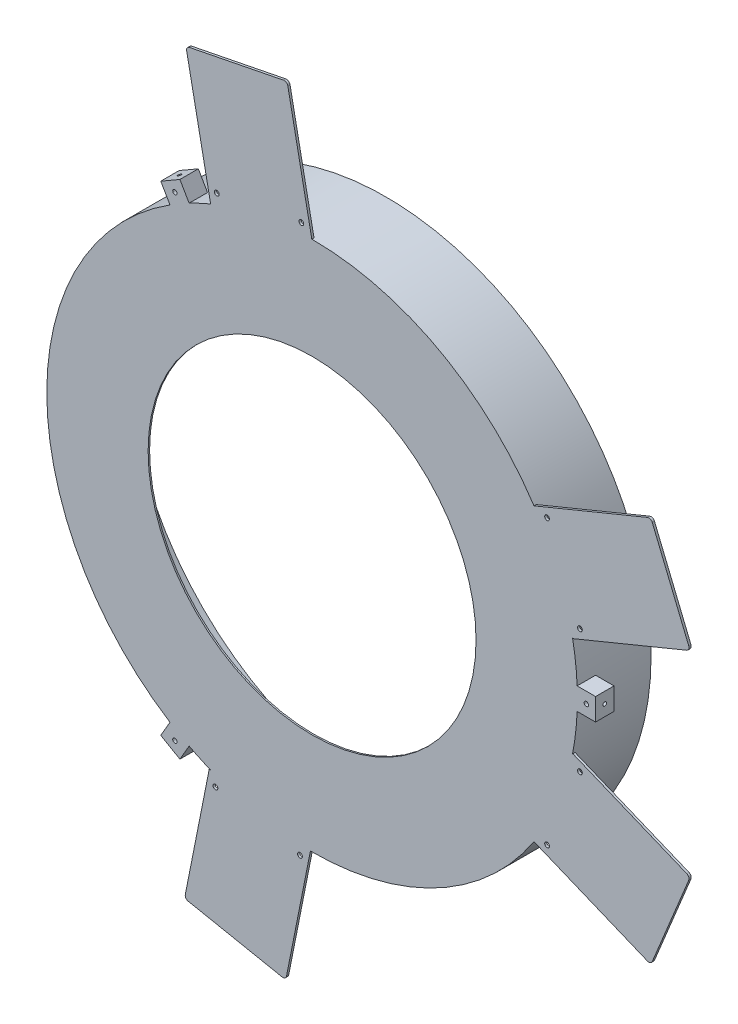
SolidWorks part; units mm, degrees
ref_plane "Plan de face" through (0, 0, 0) normal (0, 0, 1) x (1, 0, 0)
ref_plane "Plan de dessus" through (0, 0, 0) normal (0, 1, 0) x (1, 0, 0)
ref_plane "Plan de droite" through (0, 0, 0) normal (1, 0, 0) x (0, 0, -1)
sketch "Esquisse1" plane through (0, 0, 0) normal (0, 0, 1) x (1, 0, 0)
  circle A0 centre (0, 0) radius 360
  dimension "D1" = 720
extrude "Extrusion1" add sketch "Esquisse1" along normal blind 100
sketch "Esquisse2" plane through (0, 0, 100) normal (0, 0, 1) x (1, 0, 0)
  line L0 (0, 360) -> (0, -360) construction
  line L1 (0, 0) -> (-68.6912, 353.3858) construction
  line L2 (0, 0) -> (332.3557, 138.3463) construction
  line L3 (0, 0) -> (332.3557, -138.3463) construction
  line L4 (0, 0) -> (-68.6912, -353.3858) construction
  line L5 (0, 360) -> (-137.6808, 332.6319)
  line L6 (0, 0) -> (360, 0) construction
  line L7 (-33.8682, 528.6088) -> (-171.1863, 501.3369)
  line L8 (-171.1863, 501.3369) -> (-137.6808, 332.6319)
  line L9 (-33.8682, 528.6088) -> (-0.3628, 359.9038)
  line L10 (299.8516, 199.221) -> (353.9556, 67.6779)
  line L11 (513.0152, 133.1304) -> (353.9556, 67.6779)
  line L12 (459.7399, 262.5976) -> (513.0152, 133.1304)
  line L13 (459.7399, 262.5976) -> (300.6803, 197.145)
  line L14 (299.8516, -199.221) -> (353.9556, -67.6779)
  line L15 (459.7399, -262.5976) -> (300.6803, -197.145)
  line L16 (459.7399, -262.5976) -> (513.0152, -133.1304)
  line L17 (513.0152, -133.1304) -> (353.9556, -67.6779)
  line L18 (0, 0) -> (170.1183, -317.2692) construction
  line L19 (-35.6931, -528.2464) -> (-173.0111, -500.9745)
  line L20 (-173.0111, -500.9745) -> (-139.5057, -332.2695)
  line L21 (0, -360) -> (-139.5057, -332.2695)
  line L22 (-35.6931, -528.2464) -> (-2.1876, -359.5414)
  circle A0 centre (-129.3231, 349.5847) radius 3.25
  circle A1 centre (0, 0) radius 360 construction
  circle A2 centre (-14.5645, 372.3762) radius 3.25
  circle A5 centre (318.9279, 192.2183) radius 3.25
  circle A6 centre (363.4509, 84.0208) radius 3.25
  circle A7 centre (363.4509, -84.0208) radius 3.25
  circle A8 centre (318.9279, -192.2183) radius 3.25
  circle A9 centre (-16.3893, -372.0138) radius 3.25
  circle A10 centre (-131.148, -349.2223) radius 3.25
  dimension "D5" = 11.5
  dimension "D7" = 11.5
  dimension "D8" = 157
  dimension "D11" = 11.5
  dimension "D12" = 157
  dimension "D13" = 11.5
  dimension "D14" = 157
  dimension "D15" = 6.5
  dimension "D16" = 6.5
  dimension "D17" = 11.5
  dimension "D18" = 157
  dimension "D19" = 11.5
  dimension "D20" = 157
  dimension "D21" = 11.5
  dimension "D22" = 11.5
  dimension "D23" = 157
  dimension "D24" = 157
  dimension "D1" = 172
  dimension "D2" = 172
  dimension "D3" = 22.6
  dimension "D4" = 39.2
  dimension "D6" = 140
  dimension "D9" = 157
  dimension "D10" = 140
extrude "Extrusion6" add sketch "Esquisse2" against normal blind 3
fillet "Congé1" radius 5 8 edges at (-173.0111, -500.9745, 98.5) (-35.6931, -528.2464, 98.5) (459.7399, -262.5976, 98.5) (513.0152, -133.1304, 98.5) (513.0152, 133.1304, 98.5) (459.7399, 262.5976, 98.5) (-171.1863, 501.3369, 98.5) (-33.8682, 528.6088, 98.5)
sketch "Esquisse5" plane through (0, 0, 0) normal (0, 0, -1) x (-1, 0, 0)
  circle A0 centre (0, 0) radius 350.5261
extrude "Enlèv. mat.-Extru.1" cut sketch "Esquisse5" against normal blind 98
sketch "Esquisse6" plane through (0, 0, 100) normal (0, 0, 1) x (1, 0, 0)
  circle A0 centre (0, 0) radius 222.5
extrude "Enlèv. mat.-Extru.2" cut sketch "Esquisse6" against normal blind 98
sketch "Esquisse7" plane through (0, 0, 100) normal (0, 0, 1) x (1, 0, 0)
  line L0 (359.6874, 0) -> (0, 0) construction
  line L1 (384.6874, -15) -> (384.6874, 15)
  line L2 (384.6874, 15) -> (359.6874, 15)
  line L3 (359.6874, 15) -> (359.6874, -15)
  line L4 (359.6874, -15) -> (384.6874, -15)
  line L5 (0, 0) -> (-202.6999, 351.0866) construction
  line L6 (0, 0) -> (220.426, 381.7891) construction
  line L7 (-192.8341, 303.9984) -> (-205.3341, 325.649)
  line L8 (-166.8533, 318.9984) -> (-192.8341, 303.9984)
  line L9 (-205.3341, 325.649) -> (-179.3533, 340.649)
  line L10 (-179.3533, 340.649) -> (-166.8533, 318.9984)
  line L11 (-166.8533, -318.9984) -> (-179.3533, -340.649)
  line L12 (0, 0) -> (208.6678, -361.4233) construction
  line L13 (-179.3533, -340.649) -> (-205.3341, -325.649)
  line L14 (-192.8341, -303.9984) -> (-166.8533, -318.9984)
  line L15 (-205.3341, -325.649) -> (-192.8341, -303.9984)
  arc A0 (353.2473, -69.4) -> (353.2473, 69.4) centre (0, 0) ccw construction
  circle A1 centre (372.1874, 0) radius 3
  circle A2 centre (-186.0937, 322.3237) radius 3
  circle A3 centre (-186.0937, -322.3237) radius 3
  dimension "D3" = 6
  dimension "D4" = 12.5
  dimension "D5" = 120
  dimension "D1" = 25
  dimension "D2" = 30
  dimension "D6" = 60
  dimension "D7" = 60
extrude "Extrusion7" add sketch "Esquisse7" against normal blind 25
sketch "Esquisse8" plane through (384.6874, 0, 0) normal (1, 0, 0) x (0, 0, -1)
  line L0 (-75, -15) -> (-75, 15) construction
  circle A0 centre (-88.9719, 0) radius 2.5
  dimension "D1" = 5
  dimension "D2" = 13.9719
sketch "Esquisse10" plane through (384.6874, 0, 0) normal (1, 0, 0) x (0, 0, -1)
  line L0 (-75, -15) -> (-75, 15) construction
  line L3 (-75, -15) -> (-100, -15) construction
  circle A0 centre (-87.5, 0) radius 2.5
  dimension "D1" = 5
  dimension "D2" = 12.5
  dimension "D3" = 15
extrude "Enlèv. mat.-Extru.3" cut sketch "Esquisse10" against normal blind 5
sketch "Esquisse11" plane through (-192.3437, 333.149, 0) normal (-0.5, 0.866, 0) x (0.866, 0.5, 0)
  line L0 (15, -75) -> (15, -100) construction
  line L1 (15, -75) -> (-15, -75) construction
  circle A0 centre (0, -87.5) radius 2.5
  point P2 (15, -87.5)
  dimension "D1" = 5
  dimension "D2" = 15
  dimension "D3" = 12.5
extrude "Enlèv. mat.-Extru.4" cut sketch "Esquisse11" against normal blind 5
sketch "Esquisse12" plane through (-192.3437, -333.149, 0) normal (-0.5, -0.866, 0) x (0.866, -0.5, 0)
  line L0 (-15, 75) -> (15, 75) construction
  line L1 (15, 75) -> (15, 100) construction
  circle A0 centre (0, 87.5) radius 2.5
  dimension "D1" = 5
  dimension "D2" = 12.5
  dimension "D3" = 15
extrude "Enlèv. mat.-Extru.5" cut sketch "Esquisse12" against normal blind 5
